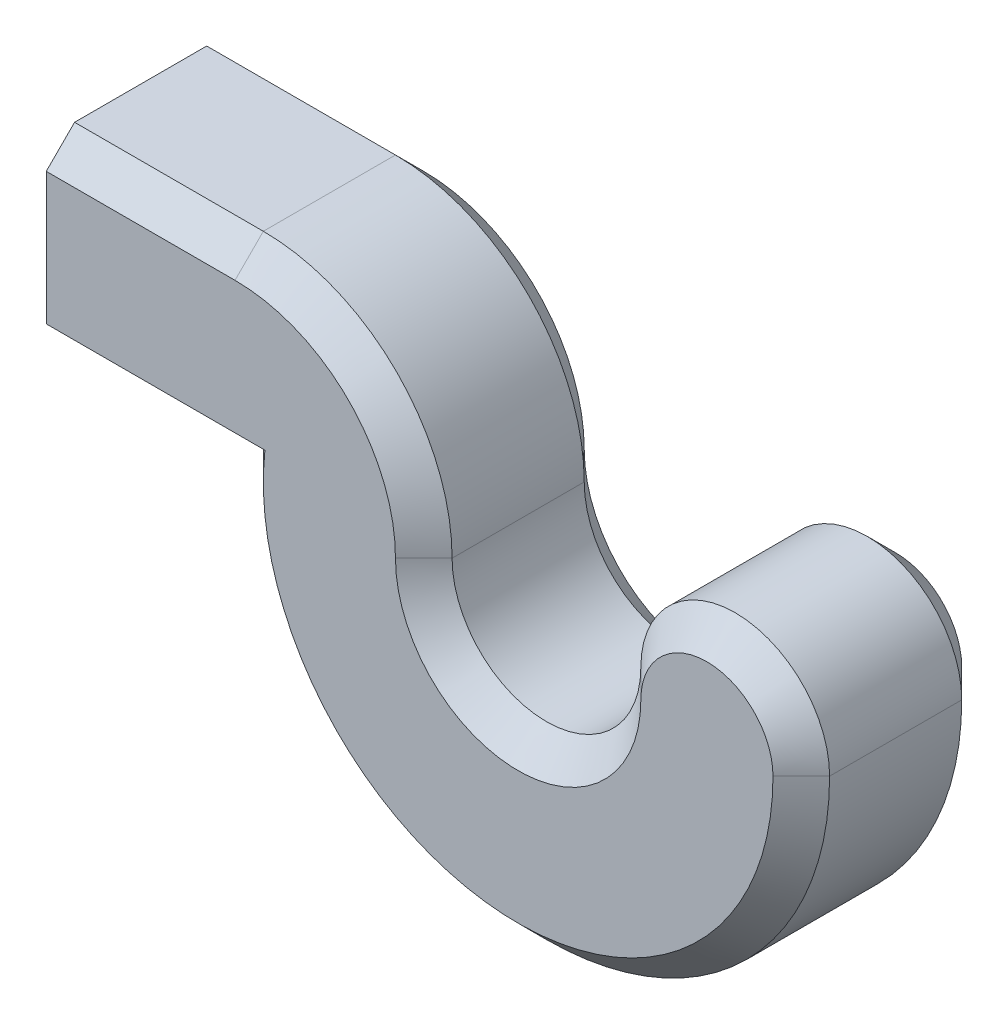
SolidWorks part; units mm, degrees
ref_plane "Спереди" through (0, 0, 0) normal (0, 0, 1) x (1, 0, 0)
ref_plane "Сверху" through (0, 0, 0) normal (0, 1, 0) x (1, 0, 0)
ref_plane "Справа" through (0, 0, 0) normal (1, 0, 0) x (0, 0, -1)
sketch "Эскиз1" plane through (0, 0, 0) normal (0, 0, 1) x (1, 0, 0)
  line L0 (0, 0) -> (0, 4)
  line L1 (0, 4) -> (4, 4)
  line L2 (0, 0) -> (4, 0)
  line L10 (12, 0) -> (16, 0) construction
  line L11 (12, 0) -> (8, 0) construction
  line L12 (8, 0) -> (4.7818, 0) construction
  arc A1 (4, 4) -> (8, 0) centre (4, 0) cw
  arc A3 (16, 0) -> (12, 0) centre (14, 0) ccw
  arc A4 (8, 0) -> (12, 0) centre (10, 0) ccw
  arc A5 (4, 0) -> (16, 0) centre (10, 0) ccw
  point P13 (16, -4)
  point P16 (8, 4)
  dimension "D3" = 6
  dimension "D4" = 2
  dimension "D5" = 4
  dimension "D1" = 10
  dimension "D2" = 4
  dimension "D6" = 4
extrude "Бобышка-Вытянуть2" add sketch "Эскиз1" along normal mid plane 4
chamfer "Фаска1" distance 0.6 angle 45 12 edges at (2, 0, 2) (10, -6, 2) (14, 2, 2) (10, -2, 2) (6.8284, 2.8284, 2) (2, 4, 2) (2, 0, -2) (10, -6, -2) (14, 2, -2) (10, -2, -2) (6.8284, 2.8284, -2) (2, 4, -2)
